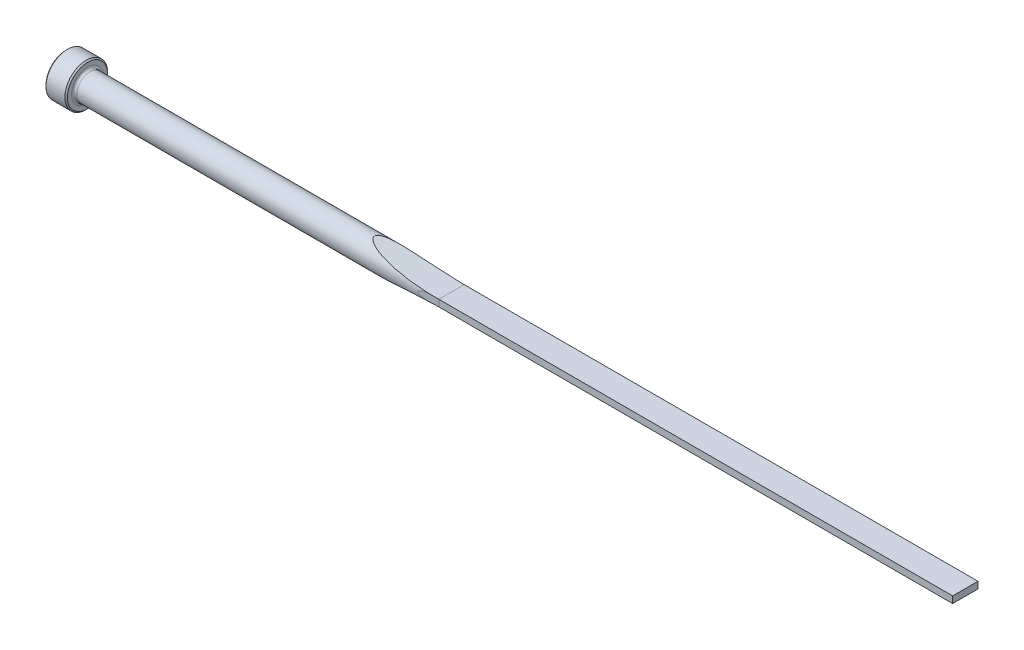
SolidWorks part; units mm, degrees
ref_plane "Front Plane" through (0, 0, 0) normal (0, 0, 1) x (1, 0, 0)
ref_plane "Top Plane" through (0, 0, 0) normal (0, 1, 0) x (1, 0, 0)
ref_plane "Right Plane" through (0, 0, 0) normal (1, 0, 0) x (0, 0, -1)
sketch "Sketch1" plane through (0, 0, 0) normal (0, 0, 1) x (1, 0, 0)
  line L0 (0, 0) -> (175.5286, 0) construction
  line L1 (0, 0) -> (0, 6.35)
  line L2 (0, 6.35) -> (6.35, 6.35)
  line L3 (6.35, 6.35) -> (6.35, 3.9624)
  line L4 (6.35, 3.9624) -> (266.7, 3.9624)
  line L5 (266.7, 3.9624) -> (266.7, 0)
  line L6 (266.7, 0) -> (0, 0)
  dimension "D1" = 266.7
  dimension "D2" = 12.7
  dimension "D3" = 7.9248
  dimension "D4" = 6.35
revolve "Revolve1" add sketch "Sketch1" angle 360 about L0
sketch "Sketch2" plane through (0, 0, 0) normal (0, 0, 1) x (1, 0, 0)
  line L0 (266.7, 3.9624) -> (266.7, 0.9906)
  line L1 (266.7, -3.9624) -> (266.7, 3.9624) construction
  line L2 (266.7, 0.9906) -> (114.3, 0.9906)
  line L3 (266.7, 3.9624) -> (6.35, 3.9624) construction
  line L4 (91.5063, 3.9624) -> (266.7, 3.9624)
  line L5 (166.0833, 0) -> (153.1705, 0) construction
  arc A0 (114.3, 0.9906) -> (91.5063, 3.9624) centre (114.3, 89.8906) cw
  dimension "D1" = 88.9
  dimension "D3" = 152.4
  dimension "D2" = 1.9812
  dimension "D4" = 22.7937
extrude "Cut-Extrude1" cut sketch "Sketch2" against normal through all both and the other way through all
mirror "Mirror1" about plane through (0, 0, 0) normal (0, 1, 0) of "Cut-Extrude1"
sketch "Sketch3" plane through (0, 0, 0) normal (0, 1, 0) x (1, 0, 0)
  line L0 (266.7, 3.9624) -> (266.7, 3.7592)
  line L1 (266.7, 3.8366) -> (266.7, -3.8366) construction
  line L2 (266.7, 3.7592) -> (114.3, 3.7592)
  line L3 (266.7, 3.9624) -> (6.35, 3.9624) construction
  line L4 (108.2927, 3.9624) -> (266.7, 3.9624)
  line L5 (163.4716, 0) -> (166.2513, 0) construction
  line L6 (114.3, 3.8366) -> (114.3, -3.8366) construction
  arc A0 (114.3, 3.7592) -> (108.2927, 3.9624) centre (114.3, 92.6592) cw
  dimension "D2" = 88.9
  dimension "D1" = 7.5184
extrude "Cut-Extrude2" cut sketch "Sketch3" against normal through all both and the other way through all
mirror "Mirror2" about plane through (0, 0, 0) normal (0, 0, 1) of "Cut-Extrude2"
fillet "Fillet1" radius 0.762 1 edges at (6.35, 0, 3.9624)
chamfer "Chamfer1" distance 0.381 angle 45 2 edges at (0, 0, 6.35) (6.35, 0, 6.35)
